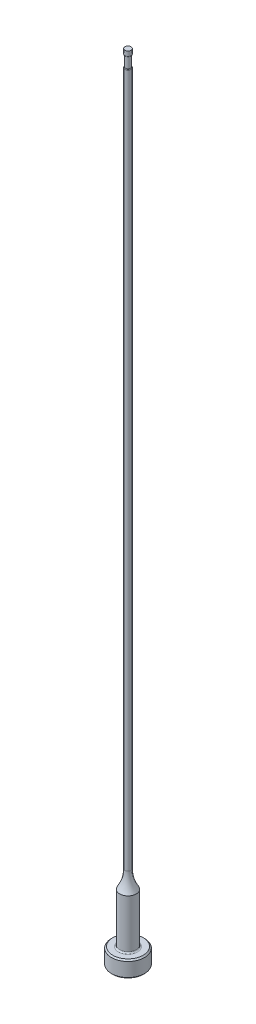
SolidWorks part; units mm, degrees
ref_plane "Front Plane" through (0, 0, 0) normal (0, 0, 1) x (1, 0, 0)
ref_plane "Top Plane" through (0, 0, 0) normal (0, 1, 0) x (1, 0, 0)
ref_plane "Right Plane" through (0, 0, 0) normal (1, 0, 0) x (0, 0, -1)
other "Configuration Table"
sketch "Sketch1" plane through (0, 0, 0) normal (0, 0, 1) x (1, 0, 0)
  line L0 (0, 259.9588) -> (0, -15.1925) construction
  line L1 (0, 0) -> (-3.175, 0)
  line L2 (-3.175, 0) -> (-3.175, 3.175)
  line L3 (-3.175, 3.175) -> (-1.5875, 3.175)
  line L4 (-0.5944, 16.1098) -> (-0.5944, 152.4)
  line L5 (-0.5944, 152.4) -> (0, 152.4)
  line L6 (0, 152.4) -> (0, 0)
  line L7 (-1.5875, 3.175) -> (-1.5875, 12.7)
  arc A1 (-1.5875, 12.7) -> (-0.5944, 16.1098) centre (-6.9444, 16.1098) ccw
  dimension "D1" = 6.35
  dimension "L" = 152.4
  dimension "D2" = 3.175
  dimension "H" = 6.35
  dimension "T" = 3.175
  dimension "D" = 1.1887
  dimension "S" = 12.7
revolve "Revolve1" add sketch "Sketch1" angle 360 about L0
chamfer "Chamfer1" distance 0.254 angle 45 2 edges at (0, 3.175, 3.175) (0, 0, 3.175)
fillet "Fillet1" radius 0.254 1 edges at (0, 3.175, 1.5875)
sketch "Sketch2" plane through (0, 0, 0) normal (0, 0, 1) x (1, 0, 0)
  line L0 (-0.5944, 152.4) -> (-0.5944, 16.1098) construction
  line L1 (-0.5944, 151.384) -> (-0.4928, 151.384)
  line L2 (-0.5944, 151.384) -> (-0.5944, 149.352)
  line L3 (-0.5944, 149.352) -> (-0.4928, 149.352)
  line L4 (-0.4928, 151.384) -> (-0.4928, 149.352)
  line L5 (0.5944, 152.4) -> (-0.5944, 152.4) construction
  line L6 (0, 153.4483) -> (0, 147.3282) construction
  dimension "D1" = 2.032
  dimension "N" = 1.016
  dimension "FD" = 0.1016
  dimension "D3" = 0.9855
revolve "Vent Relief" cut sketch "Sketch2" angle 360 about L6
sketch "Sketch3" plane through (0, 0, 0) normal (0, 0, 1) x (1, 0, 0)
  line L0 (-0.4928, 150.368) -> (-0.4928, 112.268)
  line L1 (-0.4928, 151.384) -> (-0.4928, 149.352) construction
  line L2 (-0.5944, 149.352) -> (-0.5944, 16.1098) construction
  line L3 (-0.5944, 111.4712) -> (-0.5944, 150.368)
  line L4 (-0.5944, 150.368) -> (-0.4928, 150.368)
  arc A0 (-0.4928, 112.268) -> (-0.5944, 111.4712) centre (-3.6678, 112.268) cw
  dimension "D1" = 3.175
  dimension "D2" = 38.1
extrude "D-Slot" cut sketch "Sketch3" against normal through all both and the other way through all
sketch "Sketch5" plane through (0, 0, 0) normal (0, 0, 1) x (1, 0, 0)
  line L0 (-0.5944, 151.384) -> (0.5944, 151.384) construction
  line L1 (-0.5944, 152.4) -> (-0.5893, 152.4)
  line L2 (-0.5944, 152.4) -> (-0.5944, 151.384)
  line L3 (-0.5944, 151.384) -> (-0.5893, 151.384)
  line L4 (-0.5893, 152.4) -> (-0.5893, 151.384)
  line L5 (0, 152.6877) -> (0, 150.5771) construction
  dimension "VP" = 0.0051
revolve "Vent Diameter" cut sketch "Sketch5" angle 360 about L5
fillet "Fillet2" radius 0.127 2 edges at (0.5944, 149.352, 0) (0, 151.384, 0.5893)
sketch "Pocket Sketch" plane through (0, 0, 0) normal (0, 0, 1) x (1, 0, 0)
  line L0 (-3.5719, 0) -> (-3.5719, 3.2004)
  line L1 (-3.5719, 3.2004) -> (-1.5548, 3.2004)
  line L2 (-0.7928, 3.9624) -> (-0.7928, 22.225)
  line L3 (-0.7928, 22.225) -> (0, 22.225)
  line L4 (0, 22.225) -> (0, 0)
  line L5 (0, 0) -> (-3.5719, 0)
  line L6 (0, 12.6104) -> (0, -2.4989) construction
  line L7 (-3.175, 2.921) -> (-3.175, 0.254) construction
  line L8 (2.921, 3.175) -> (-2.921, 3.175) construction
  line L9 (-0.5944, 111.4712) -> (-0.5944, 16.1098) construction
  line L10 (-1.5548, 3.2004) -> (-0.7928, 3.9624)
  point P3 (-0.7928, 3.2004)
  dimension "D1" = 7.1437
  dimension "D2" = 0.3969
  dimension "D3" = 0.0254
  dimension "D4" = 0.1984
  dimension "D5" = 1.5856
  dimension "D6" = 22.225
